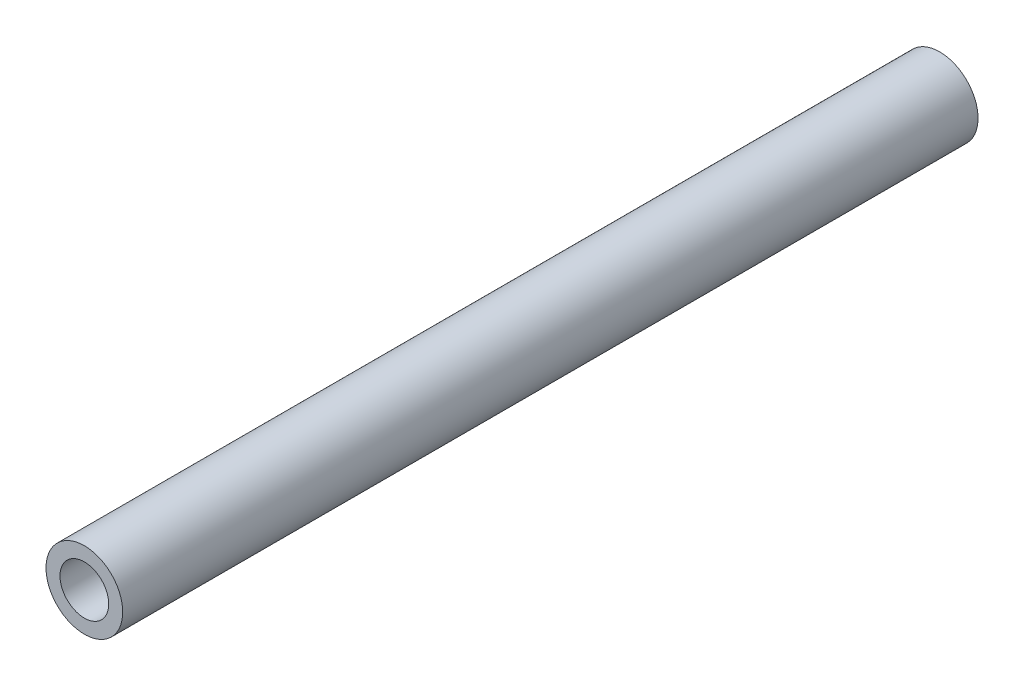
SolidWorks part; units mm, degrees
ref_plane "Спереди" through (0, 0, 0) normal (0, 0, 1) x (1, 0, 0)
ref_plane "Сверху" through (0, 0, 0) normal (0, 1, 0) x (1, 0, 0)
ref_plane "Справа" through (0, 0, 0) normal (1, 0, 0) x (0, 0, -1)
sketch "Эскиз1" plane through (0, 0, 0) normal (0, 0, 1) x (1, 0, 0)
  circle A0 centre (0, 0) radius 3.175
  circle A1 centre (0, 0) radius 5
  dimension "D1" = 6.35
  dimension "D2" = 10
extrude "Бобышка-Вытянуть1" add sketch "Эскиз1" along normal blind 111.5
